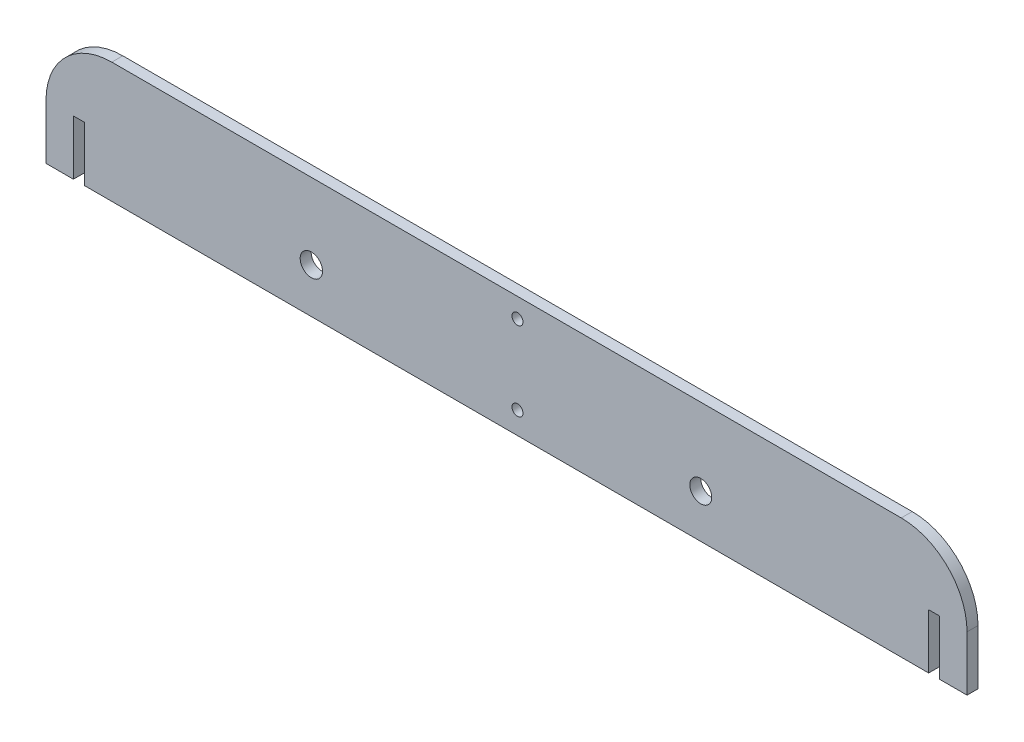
SolidWorks part; units mm, degrees
ref_plane "Alzado" through (0, 0, 0) normal (0, 0, 1) x (1, 0, 0)
ref_plane "Planta" through (0, 0, 0) normal (0, 1, 0) x (1, 0, 0)
ref_plane "Vista lateral" through (0, 0, 0) normal (1, 0, 0) x (0, 0, -1)
sketch "Croquis1" plane through (0, 0, 0) normal (0, 0, 1) x (1, 0, 0)
  line L0 (210, 0) -> (-210, 0)
  line L1 (-210, 0) -> (-210, 25)
  line L2 (-180, 55) -> (180, 55)
  line L3 (0, 0) -> (0, 55) construction
  line L4 (210, 0) -> (210, 25)
  arc A0 (-210, 25) -> (-180, 55) centre (-180, 25) cw
  arc A1 (210, 25) -> (180, 55) centre (180, 25) ccw
  dimension "D3" = 30
  dimension "D1" = 55
  dimension "D2" = 210
extrude "Saliente-Extruir1" add sketch "Croquis1" along normal mid plane 5
sketch "Croquis2" plane through (0, 0, 2.5) normal (0, 0, 1) x (1, 0, 0)
  line L0 (-210, 0) -> (210, 0) construction
  line L1 (197.5, 0) -> (192.5, 0)
  line L2 (197.5, 0) -> (197.5, 25)
  line L3 (197.5, 25) -> (192.5, 25)
  line L4 (192.5, 0) -> (192.5, 25)
  line L5 (-197.5, 25) -> (-192.5, 25)
  line L6 (-197.5, 25) -> (-197.5, 0)
  line L7 (-197.5, 0) -> (-192.5, 0)
  line L8 (-192.5, 25) -> (-192.5, 0)
  circle A0 centre (-89, 20.4413) radius 5.0933
  circle A1 centre (88.5802, 19.8636) radius 5
  circle A2 centre (5, 10.1) radius 2.5
  circle A3 centre (5, 46.0944) radius 2.5056
  point P25 (-183.5, 25)
  dimension "D1" = 10
extrude "Cortar-Extruir1" cut sketch "Croquis2" against normal through all
